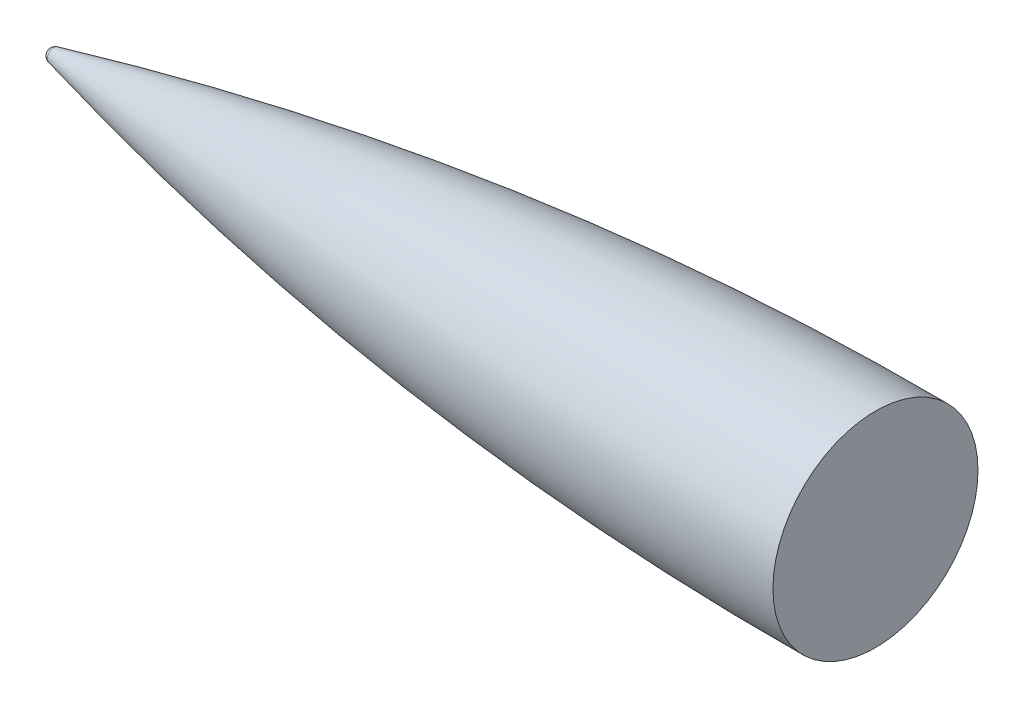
SolidWorks part; units mm, degrees
ref_plane "Front Plane" through (0, 0, 0) normal (0, 0, 1) x (1, 0, 0)
ref_plane "Top Plane" through (0, 0, 0) normal (0, 1, 0) x (1, 0, 0)
ref_plane "Right Plane" through (0, 0, 0) normal (1, 0, 0) x (0, 0, -1)
sketch "Sketch1" plane through (0, 0, 0) normal (0, 0, 1) x (1, 0, 0)
  line L0 (0, 0) -> (325.525, 0) construction
  line L1 (325.525, 0) -> (325.525, 39.37)
  line L2 (8.025, 0) -> (8.025, 30.9534) construction
  line L3 (325.525, 0) -> (8.025, 0)
  arc A1 (9.9641, 2.4679) -> (8.025, 0) centre (10.565, 0) ccw
  arc A2 (325.525, 39.37) -> (9.9641, 2.4679) centre (317.6933, -1261.3375) ccw
  arc A3 (13.105, 0) -> (9.9641, 2.4679) centre (10.565, 0) ccw construction
  arc A4 (8.025, 0) -> (13.105, 0) centre (10.565, 0) ccw construction
  arc A5 (8.025, 1.9942) -> (0, 0) centre (317.6933, -1261.3375) ccw construction
  arc A6 (9.9641, 2.4679) -> (8.025, 1.9942) centre (317.6933, -1261.3375) ccw construction
  point P4 (10.565, 0)
  point P5 (9.9641, 2.4679)
  point P11 (8.025, 0)
revolve "Revolve1" add sketch "Sketch1" angle 360 about L3
equation "\"r_n\"= 0.1'nose tip radius"
equation "\"R_nc\"= 3.1 / 2'nosecone base radius"
equation "\"L_nc\"= 12.5'exposed length of the nosecone"
equation "\"rho\"= ( \"R_nc\" ^ 2 + \"L_nc\" ^ 2 ) / ( 2 * \"R_nc\" )'ogive radius"
equation "\"x_0\"= \"L_nc\" - sqr ( ( \"rho\" - \"r_n\" ) ^ 2 - ( \"rho\" - \"R_nc\" ) ^ 2 )'center of tip sphere"
equation "\"y_t\"= \"r_n\" * ( \"rho\" - \"R_nc\" ) / ( \"rho\" - \"r_n\" )'y-coordinate of tangency point"
equation "\"x_t\"= \"x_0\" - sqr ( \"r_n\" ^ 2 - \"y_t\" ^ 2 )'x-coordinate of tangency point"
equation "\"x_a\"= \"x_0\" - \"r_n\"'apex point"
equation "\"D1@Sketch1\"=\"R_nc\""
equation "\"D2@Sketch1\"=\"x_0\""
equation "\"D3@Sketch1\"=\"y_t\""
equation "\"D4@Sketch1\"=\"x_t\""
equation "\"D5@Sketch1\"=\"L_nc\""
